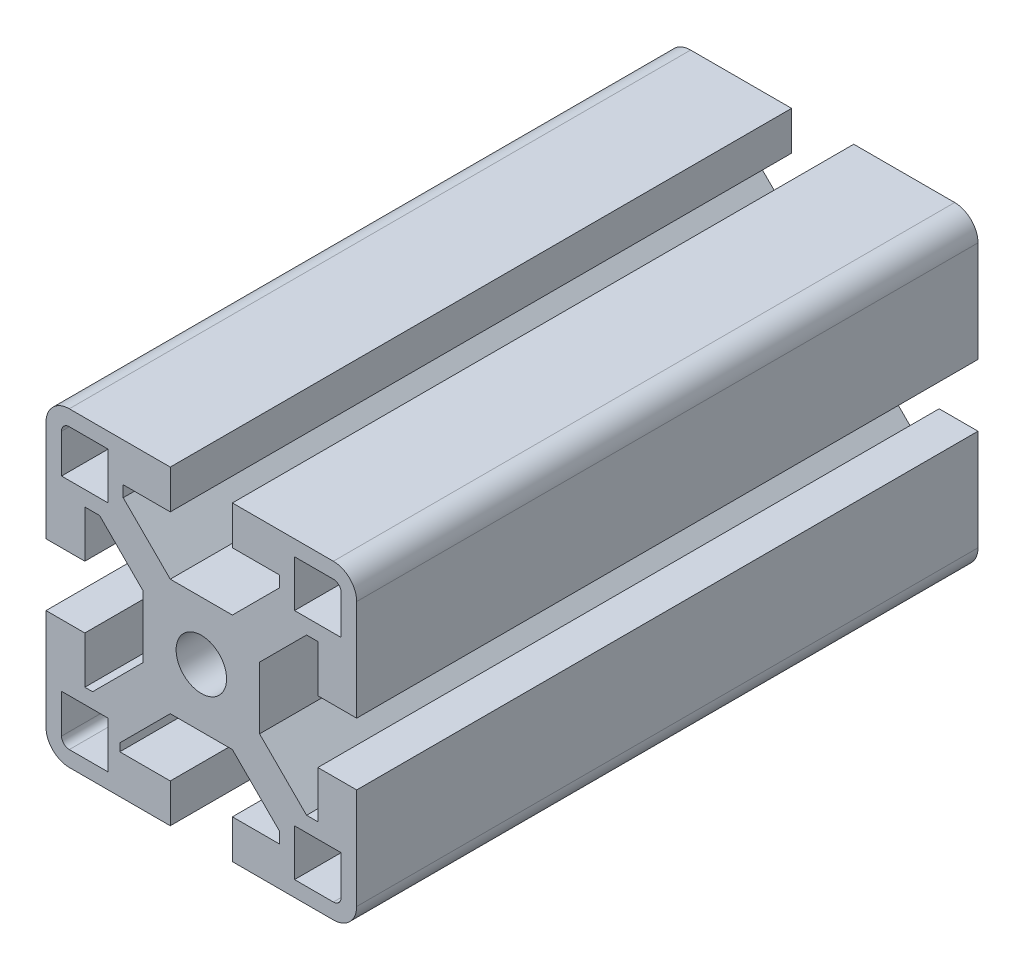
SolidWorks part; units mm, degrees
ref_plane "Alzado" through (0, 0, 0) normal (0, 0, 1) x (1, 0, 0)
ref_plane "Planta" through (0, 0, 0) normal (0, 1, 0) x (1, 0, 0)
ref_plane "Vista lateral" through (0, 0, 0) normal (1, 0, 0) x (0, 0, -1)
sketch "Croquis1" plane through (0, 0, 0) normal (0, 0, 1) x (1, 0, 0)
  line L0 (-18, 12) -> (-12, 12)
  line L1 (-12, 12) -> (-12, 18)
  line L2 (-17, 18) -> (-12, 18)
  line L3 (-18, 12) -> (-18, 17)
  line L4 (12, 12) -> (18, 12)
  line L5 (12, 12) -> (12, 18)
  line L6 (12, 18) -> (17, 18)
  line L7 (18, 12) -> (18, 17)
  line L8 (-17, -18) -> (-12, -18)
  line L9 (-12, -18) -> (-12, -12)
  line L10 (-18, -12) -> (-12, -12)
  line L11 (-18, -17) -> (-18, -12)
  line L12 (18, -12) -> (12, -12)
  line L13 (18, -17) -> (18, -12)
  line L14 (17, -18) -> (12, -18)
  line L15 (12, -18) -> (12, -12)
  line L16 (-4, 7.5) -> (4, 7.5)
  line L17 (-17, 20) -> (-4, 20)
  line L18 (-7.5, -3.55) -> (-7.5, 4.45)
  line L19 (-4, -7.5) -> (4, -7.5)
  line L20 (7.5, -4) -> (7.5, 4)
  line L21 (20, -4) -> (15, -4)
  line L22 (4, 20) -> (4, 15)
  line L24 (4, 20) -> (17, 20)
  line L25 (-17, -20) -> (-4, -20)
  line L26 (-4, -20) -> (-4, -15)
  line L27 (17, -20) -> (4, -20)
  line L28 (-15, -10.05) -> (-15, -4)
  line L29 (-20, 4) -> (-20, 17)
  line L30 (-20, -17) -> (-20, -4)
  line L31 (-20, -4) -> (-15, -4)
  line L32 (4, -20) -> (4, -15)
  line L33 (-4, 20) -> (-4, 15)
  line L34 (20, 4) -> (20, 17)
  line L35 (20, -17) -> (20, -4)
  line L36 (20, 4) -> (15, 4)
  line L37 (4, -15) -> (10.05, -15)
  line L38 (-10.5, -15) -> (-4, -15)
  line L39 (-10.5, -14) -> (-4, -7.5)
  line L40 (-10.5, -14) -> (-10.5, -15)
  line L41 (4, -7.5) -> (10.05, -13.55)
  line L42 (10.05, -15) -> (10.05, -13.55)
  line L43 (-7.5, -3.55) -> (-14, -10.05)
  line L44 (-15, -10.05) -> (-14, -10.05)
  line L45 (-20, 4) -> (-15, 4)
  line L46 (-15, 4) -> (-15, 10.05)
  line L47 (-7.5, 4.45) -> (-13.1, 10.05)
  line L48 (-15, 10.05) -> (-13.1, 10.05)
  line L49 (4, 15) -> (10.05, 15)
  line L50 (4, 7.5) -> (10.05, 13.55)
  line L51 (10.05, 13.55) -> (10.05, 15)
  line L52 (-10.0629, 15) -> (-4, 15)
  line L53 (-10.0629, 13.55) -> (-4, 7.5)
  line L54 (-10.0629, 13.55) -> (-10.0629, 15)
  line L55 (15, 4) -> (15, 10.05)
  line L56 (15, -10.05) -> (15, -4)
  line L57 (7.5, -4) -> (13.55, -10.05)
  line L58 (13.55, -10.05) -> (15, -10.05)
  line L59 (7.5, 4) -> (13.55, 10.05)
  line L60 (13.55, 10.05) -> (15, 10.05)
  arc A0 (-18, 17) -> (-17, 18) centre (-17, 17) cw
  arc A1 (18, 17) -> (17, 18) centre (17, 17) ccw
  arc A2 (-18, -17) -> (-17, -18) centre (-17, -17) ccw
  arc A3 (17, -18) -> (18, -17) centre (17, -17) ccw
  circle A4 centre (0, 0) radius 3.25
  arc A5 (17, 20) -> (20, 17) centre (17, 17) cw
  arc A6 (-20, 17) -> (-17, 20) centre (-17, 17) cw
  arc A7 (-17, -20) -> (-20, -17) centre (-17, -17) cw
  arc A8 (17, -20) -> (20, -17) centre (17, -17) ccw
extrude "Extruir5" add sketch "Croquis1" along normal blind 80
